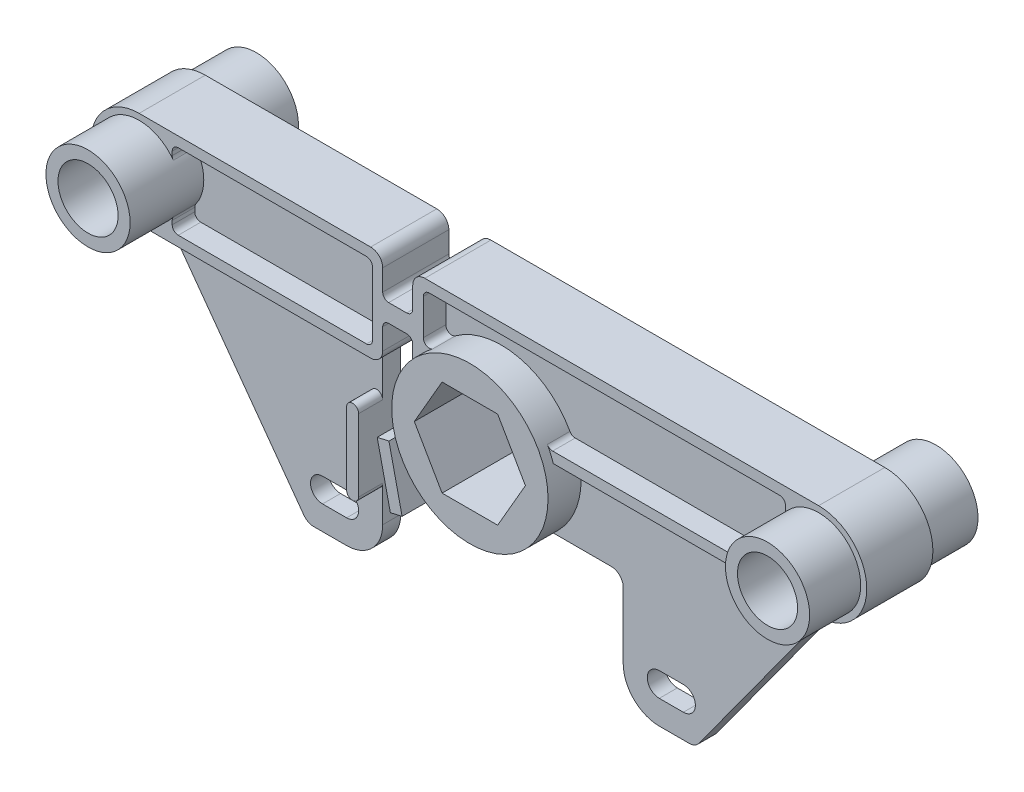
SolidWorks part; units mm, degrees
ref_plane "Plan1" through (0, 0, 0) normal (0, 0, 1) x (1, 0, 0)
ref_plane "Plan2" through (0, 0, 0) normal (0, 1, 0) x (1, 0, 0)
ref_plane "Plan3" through (0, 0, 0) normal (1, 0, 0) x (0, 0, -1)
sketch "Esquisse1" plane through (0, 0, 0) normal (0, 0, 1) x (1, 0, 0)
  circle A0 centre (0, 0) radius 13
  dimension "D1" = 26
extrude "Moyeu" add sketch "Esquisse1" along normal mid plane 14
sketch "Esquisse2" plane through (0, 0, 0) normal (0, 0, 1) x (1, 0, 0)
  line L0 (-11, 20) -> (56.5, 20)
  line L1 (-11, 20) -> (-11, 13.5)
  line L2 (-11, 4) -> (56.5, 4)
  line L3 (-16, 20) -> (-16, 13.5)
  line L4 (-16, 20) -> (-56.5, 20)
  line L5 (-16, 4) -> (-56.5, 4)
  line L6 (-16, 13.5) -> (-11, 13.5)
  line L7 (-16, 10.5) -> (-11, 10.5)
  line L8 (-16, 10.5) -> (-16, 4)
  line L9 (-11, 10.5) -> (-11, 4)
  arc A0 (56.5, 4) -> (56.5, 20) centre (56.5, 12) ccw
  arc A1 (-56.5, 20) -> (-56.5, 4) centre (-56.5, 12) ccw
  dimension "D1" = 20
  dimension "D2" = 11
  dimension "D3" = 16
  dimension "D4" = 67.5
  dimension "D5" = 5
  dimension "D6" = 40.5
  dimension "D7" = 3
  dimension "D8" = 1.5
extrude "poutre" add sketch "Esquisse2" along normal mid plane 11
sketch "Esquisse3" plane through (0, 0, 0) normal (0, 0, 1) x (1, 0, 0)
  circle A0 centre (56.5, 12) radius 7
  dimension "D1" = 14
extrude "palier grand côté" add sketch "Esquisse3" along normal mid plane 28
sketch "Esquisse7" plane through (0, 0, 0) normal (0, 0, 1) x (1, 0, 0)
  circle A0 centre (-56.5, 12) radius 7
  arc A1 (-56.5, 20) -> (-56.5, 4) centre (-56.5, 12) ccw construction
  dimension "D1" = 14
extrude "palier petit côté" add sketch "Esquisse7" along normal mid plane 28
sketch "Esquisse8" plane through (0, 0, 14) normal (0, 0, 1) x (1, 0, 0)
  circle A0 centre (-56.5, 12) radius 5
  circle A1 centre (-56.5, 12) radius 7 construction
  dimension "D1" = 10
extrude "alésage petit côté" cut sketch "Esquisse8" against normal through all
sketch "Esquisse9" plane through (0, 0, 14) normal (0, 0, 1) x (1, 0, 0)
  circle A0 centre (56.5, 12) radius 5
  circle A1 centre (56.5, 12) radius 7 construction
  dimension "D1" = 10
extrude "alésage grand côté" cut sketch "Esquisse9" against normal through all
sketch "Esquisse10" plane through (0, 0, 5.5) normal (0, 0, 1) x (1, 0, 0)
  line L10 (-51, 18.3) -> (-51, 16.3301)
  line L11 (-51, 7.6699) -> (-51, 5.7)
  line L20 (-17.7, 18.3) -> (-56.5, 18.3)
  line L21 (-56.5, 5.7) -> (-17.7, 5.7)
  line L22 (-17.7, 5.7) -> (-17.7, 18.3)
  line L23 (-17.7, 18.3) -> (-51, 18.3)
  line L24 (-51, 5.7) -> (-17.7, 5.7)
  line L25 (-17.7, 5.7) -> (-17.7, 18.3)
  circle A3 centre (-56.5, 12) radius 7 construction
  arc A4 (-51, 7.6699) -> (-51, 16.3301) centre (-56.5, 12) ccw
  arc A6 (-56.5, 18.3) -> (-56.5, 5.7) centre (-56.5, 12) ccw
  dimension "D2" = 5.5
  dimension "D1" = 1.7
extrude "évidement poutre petit côté" cut sketch "Esquisse10" against normal blind 3.75
sketch "Esquisse11" plane through (0, 0, 5.5) normal (0, 0, 1) x (1, 0, 0)
  line L0 (51, 18.25) -> (-9.25, 18.25)
  line L1 (56.5, 20) -> (-11, 20) construction
  line L2 (51, 5.75) -> (11.6592, 5.75)
  line L4 (12.3693, 4) -> (56.5, 4) construction
  line L5 (-9.25, 18.25) -> (-9.25, 9.1344)
  line L6 (-11, 20) -> (-11, 13.5) construction
  line L7 (51, 18.25) -> (51, 16.3301)
  line L8 (51, 7.6699) -> (51, 5.75)
  circle A0 centre (0, 0) radius 13 construction
  arc A1 (11.6592, 5.75) -> (-9.25, 9.1344) centre (0, 0) ccw
  circle A4 centre (56.5, 12) radius 7 construction
  arc A5 (51, 16.3301) -> (51, 7.6699) centre (56.5, 12) ccw
  dimension "D1" = 1.75
  dimension "D2" = 1.75
  dimension "D3" = 1.75
  dimension "D4" = 5.5
extrude "évidement poutre grand côté" cut sketch "Esquisse11" against normal blind 3.75
fillet "Congés inter de 1" radius 1
mirror "Symétrie1" about plane through (0, 0, 0) normal (0, 0, 1)
sketch "Esquisse12" plane through (0, 0, 7) normal (0, 0, 1) x (1, 0, 0)
  line L0 (-4.6188, 8) -> (4.6188, 8)
  line L1 (-4.6188, -8) -> (4.6188, -8)
  line L2 (-4.6188, 8) -> (-9.2376, 0)
  line L3 (-9.2376, 0) -> (-4.6188, -8)
  line L4 (4.6188, 8) -> (9.2376, 0)
  line L5 (9.2376, 0) -> (4.6188, -8)
  dimension "D1" = 8
  dimension "D2" = 120
  dimension "D3" = 120
  dimension "D4" = 120
  dimension "D5" = 120
  dimension "D6" = 16
  dimension "D7" = 8
  dimension "D8" = 8
  dimension "D9" = 8
  dimension "D10" = 8
extrude "alésage hexagonal" cut sketch "Esquisse12" against normal through all
fillet " Congés exter de 2" radius 2
fillet "Congés de 1articulation" radius 1
sketch "Esquisse13" plane through (0, 0, 0) normal (0, 0, 1) x (1, 0, 0)
  line L0 (26, -29) -> (30.9809, -29)
  line L1 (12.3693, 4) -> (56.5, 4) construction
  line L2 (4.8666, -10) -> (18, -10)
  line L3 (20, -12) -> (20, -23)
  line L4 (56.7046, 5.003) -> (32.599, -28.1756)
  arc A0 (18, -10) -> (20, -12) centre (18, -12) cw
  circle A1 centre (56.5, 12) radius 7 construction
  arc A2 (32.599, -28.1756) -> (30.9809, -29) centre (30.9809, -27) cw
  arc A3 (26, -29) -> (20, -23) centre (26, -23) cw
  point P14 (32, -29)
  point P17 (20, -29)
  dimension "D4" = 2
  dimension "D7" = 2
  dimension "D8" = 6
  dimension "D1" = 33
  dimension "D2" = 14
  dimension "D3" = 20
  dimension "D5" = 12
  dimension "D6" = 126
rib "pate ressort grand coté" sketch "Esquisse13" sketch "Esquisse13" thickness 3 extrusion direction parallel to sketch draft on no parameters "D1"=3
sketch "Esquisse14" plane through (0, 0, 0) normal (0, 0, 1) x (1, 0, 0)
  line L0 (-20, 5.7) -> (-20, -23)
  line L1 (-50, 5.7) -> (-18.7, 5.7) construction
  line L2 (-31.4809, -29) -> (-26, -29)
  line L3 (-56.5, 4) -> (-18, 4) construction
  line L4 (-16, 6) -> (-16, 9.5) construction
  line L5 (-56.8582, 4.5262) -> (-33.099, -28.1756)
  arc A0 (-26, -29) -> (-20, -23) centre (-26, -23) ccw
  arc A1 (-31.4809, -29) -> (-33.099, -28.1756) centre (-31.4809, -27) cw
  point P15 (-32.5, -29)
  dimension "D3" = 6
  dimension "D6" = 2
  dimension "D1" = 33
  dimension "D2" = 4
  dimension "D4" = 126
  dimension "D5" = 12.5
rib "pate ressort petit côté" sketch "Esquisse14" sketch "Esquisse14" thickness 3 extrusion direction parallel to sketch draft on no parameters "D1"=3
sketch "Esquisse15" plane through (0, 0, 0) normal (0, 0, 1) x (1, 0, 0)
  line L0 (-20, -23) -> (-20, 4) construction
  line L1 (-20, -17) -> (-20, -5)
  line L2 (-22, -5) -> (-22, -17)
  line L3 (-56.5, 4) -> (-18, 4) construction
  arc A0 (-20, -5) -> (-22, -5) centre (-21, -5) ccw
  arc A1 (-22, -17) -> (-20, -17) centre (-21, -17) ccw
  dimension "D1" = 2
  dimension "D2" = 21
  dimension "D3" = 9
extrude "buté petit coté" add sketch "Esquisse15" along normal mid plane 11
sketch "Esquisse16" plane through (0, 0, 0) normal (0, 0, 1) x (1, 0, 0)
  line L0 (2.8409, -12.6858) -> (-14.7241, -16.6193)
  line L1 (-16.9094, -6.861) -> (-10.3548, -5.3932)
  line L2 (-16.9094, -6.861) -> (-14.7241, -16.6193)
  circle A0 centre (0, 0) radius 13 construction
  arc A1 (-22, -17) -> (-20, -17) centre (-21, -17) ccw construction
  dimension "D1" = 10
  dimension "D2" = 18
rib "Nervure de buté" sketch "Esquisse16" sketch "Esquisse16" thickness 3 extrusion direction parallel to sketch draft on no parameters "D1"=3
sketch "Esquisse17" plane through (0, 0, 0) normal (0, 0, 1) x (1, 0, 0)
  line L0 (-14.7241, -16.6193) -> (-16.9094, -6.861) construction
  line L1 (-14.7241, -16.6193) -> (-16.9094, -6.861)
  line L2 (-14.9577, -6.424) -> (-12.7724, -16.1823)
  line L3 (-16.9094, -6.861) -> (-14.9577, -6.424)
  line L4 (-14.7241, -16.6193) -> (-12.7724, -16.1823)
  dimension "D1" = 2
extrude "buté sur moyeu" add sketch "Esquisse17" along normal mid plane 11
fillet "Congé de buté" radius 2
sketch "Esquisse18" plane through (0, 0, 1.5) normal (0, 0, 1) x (1, 0, 0)
  line L0 (26, -21) -> (30, -21)
  line L1 (26, -25) -> (30, -25)
  line L2 (12.3693, 4) -> (56.5, 4) construction
  arc A0 (26, -21) -> (26, -25) centre (26, -23) ccw
  arc A1 (30, -25) -> (30, -21) centre (30, -23) ccw
  dimension "D1" = 4
  dimension "D2" = 25
  dimension "D3" = 4
extrude "trou oblong ressort grand coté" cut sketch "Esquisse18" against normal through all
mirror "Symétrie2" about plane through (0, 0, 0) normal (1, 0, 0)
